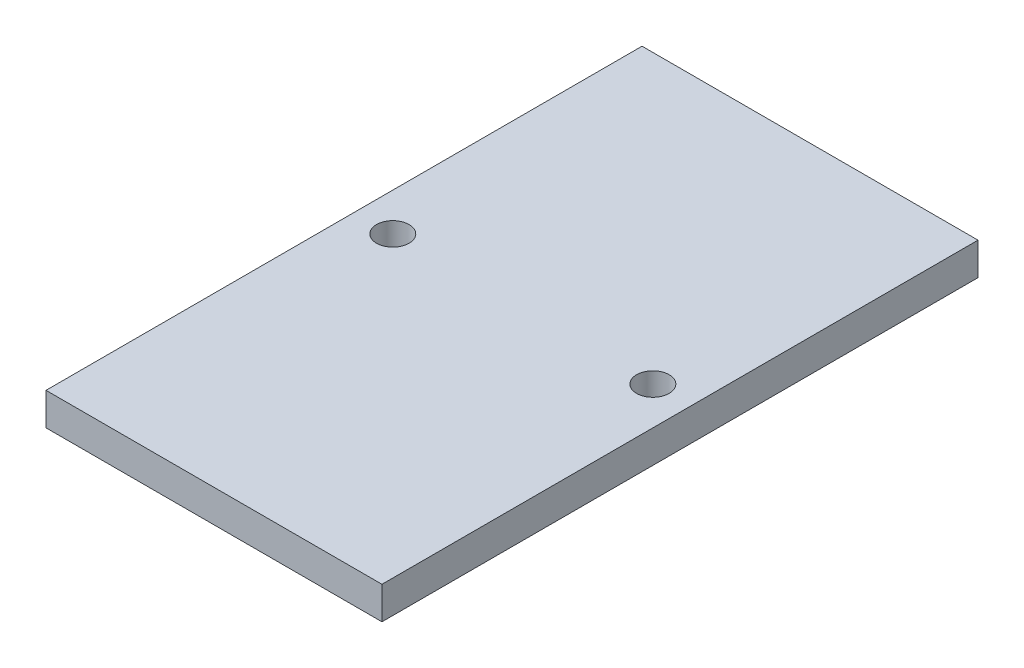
SolidWorks part; units mm, degrees
ref_plane "Front" through (0, 0, 0) normal (0, 0, 1) x (1, 0, 0)
ref_plane "Top" through (0, 0, 0) normal (0, 1, 0) x (1, 0, 0)
ref_plane "Right" through (0, 0, 0) normal (1, 0, 0) x (0, 0, -1)
sketch "Sketch1" plane through (0, 0, 0) normal (0, 1, 0) x (1, 0, 0)
  line L1 (0, 0) -> (62, 0)
  line L2 (0, 0) -> (0, 110)
  line L3 (0, 110) -> (62, 110)
  line L4 (62, 0) -> (62, 110)
  circle A0 centre (7, 57) radius 3
  circle A1 centre (55, 57) radius 3
extrude "Extrude1" add sketch "Sketch1" along normal blind 6
